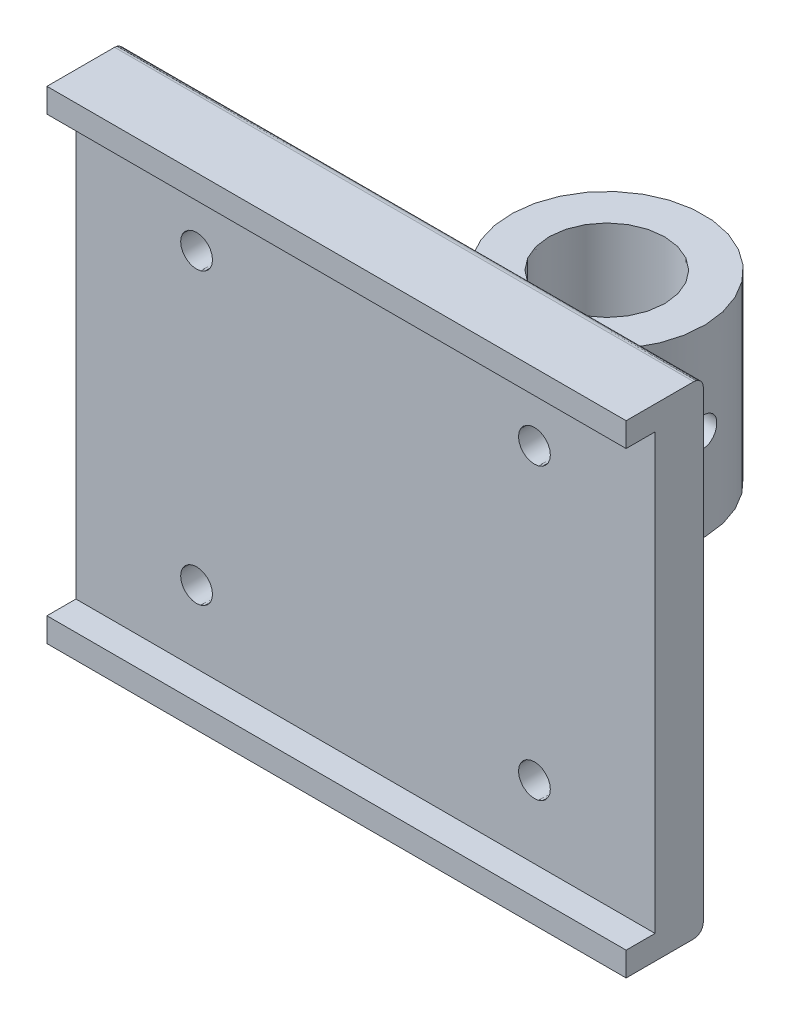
SolidWorks part; units mm, degrees
ref_plane "前视基准面" through (0, 0, 0) normal (0, 0, 1) x (1, 0, 0)
ref_plane "上视基准面" through (0, 0, 0) normal (0, 1, 0) x (1, 0, 0)
ref_plane "右视基准面" through (0, 0, 0) normal (1, 0, 0) x (0, 0, -1)
sketch "草图1" plane through (0, 0, 0) normal (0, 0, 1) x (1, 0, 0)
  line L0 (0, 15.9024) -> (0, 0) construction
  line L1 (-30, -25) -> (30, -25)
  line L2 (-30, -25) -> (-30, 25)
  line L3 (-30, 25) -> (30, 25)
  line L4 (30, -25) -> (30, 25)
  line L5 (-30, -25) -> (30, 25) construction
  line L6 (-30, 25) -> (30, -25) construction
  line L7 (0, 0) -> (-15.3171, 0) construction
  point P0 (0, 0)
  point P6 (-17.5, 15)
  point P12 (17.5, 15)
  point P13 (17.5, -15)
  point P14 (-17.5, -15)
  dimension "D1" = 50
  dimension "D2" = 60
  dimension "D3" = 35
  dimension "D4" = 30
  dimension "D5" = 2
  dimension "D6" = 2
extrude "凸台-拉伸1" add sketch "草图1" along normal blind 8
sketch "草图3" plane through (0, 0, 0) normal (0, 1, 0) x (1, 0, 0)
  line L0 (0, 0) -> (0, 37.3264) construction
  line L1 (3.5, 10.6325) -> (3.5, 0)
  line L2 (-30, 0) -> (30, 0) construction
  line L3 (-3.5, 10.6325) -> (-3.5, 0)
  line L4 (-30, 0) -> (30, 0) construction
  line L5 (-3.5, 0) -> (3.5, 0)
  circle A0 centre (0, 20) radius 6
  arc A1 (3.5, 10.6325) -> (-3.5, 10.6325) centre (0, 20) ccw
  dimension "D1" = 12
  dimension "D2" = 20
  dimension "D3" = 20
  dimension "D4" = 3.5
  dimension "D5" = 3.5
extrude "凸台-拉伸2" add sketch "草图3" along normal mid plane 19
sketch "草图4" plane through (30, 0, 0) normal (1, 0, 0) x (0, 0, -1)
  line L0 (-8, -25) -> (-8, 25) construction
  line L1 (-11, -22.5) -> (-5, -22.5)
  line L2 (-11, -22.5) -> (-11, 22.5)
  line L3 (-11, 22.5) -> (-5, 22.5)
  line L4 (-5, -22.5) -> (-5, 22.5)
  line L5 (-11, -22.5) -> (-5, 22.5) construction
  line L6 (-11, 22.5) -> (-5, -22.5) construction
  line L7 (-8, 25) -> (0, 25) construction
  line L8 (0, 25) -> (0, -25) construction
  point P0 (-8, 0)
  dimension "D1" = 2.5
  dimension "D2" = 5
extrude "切除-拉伸2" cut sketch "草图4" against normal up to surface (60 mm away)
sketch "草图7" plane through (0, 0, 0) normal (0, 0, -1) x (-1, 0, 0)
  point P0 (-17.5, -15)
  point P2 (17.5, -15)
  point P4 (17.5, 15)
  point P6 (-17.5, 15)
hole_wizard "M4 螺纹孔1" positions "3D草图4" profile "草图9" tap size "M4" standard "GB"
sketch3d "3D草图4"
  point P0 (17.5, -15, 0)
  point P3 (-17.5, -15, 0)
  point P6 (-17.5, 15, 0)
  point P9 (17.5, 15, 0)
sketch "草图9" plane through (17.5, -15, 0) normal (1, 0, 0) x (0, 1, 0)
  line L0 (0, 0) -> (0, 8)
  line L1 (0, 8) -> (1.65, 8)
  line L2 (1.65, 8) -> (1.65, 0)
  line L5 (1.65, 0) -> (0, 0)
  line L11 (0, -6.35) -> (0, 107.95) construction
  dimension "通孔螺纹孔钻头直径" = 3.3
  dimension "通孔螺纹孔钻头深度" = 8
sketch "草图10" plane through (0, 0, 0) normal (0, 1, 0) x (1, 0, 0)
  line L0 (15, 0) -> (6, 12)
  line L1 (30, 0) -> (-30, 0) construction
  arc A0 (3.5, 10.6325) -> (-3.5, 10.6325) centre (0, 20) ccw construction
  dimension "D1" = 12
  dimension "D2" = 15
rib "筋1" sketch "草图10" sketch "草图10" thickness 8 extrusion direction parallel to sketch draft on no parameters "D1"=8
mirror "镜向1" about plane through (0, 0, 0) normal (1, 0, 0) of "筋1"
sketch "草图11" plane through (0, 0, 0) normal (1, 0, 0) x (0, 0, -1)
  line L0 (26, 0) -> (14, 0) construction
  line L1 (26, -9.5) -> (26, 9.5) construction
  line L2 (14, 9.5) -> (14, -9.5) construction
  circle A0 centre (20, 0) radius 1.5
  dimension "D1" = 3
extrude "切除-拉伸3" cut sketch "草图11" against normal mid plane 41
fillet "圆角1" radius 1 6 edges at (0, -25, 0) (0, 25, 0) (-10.5, 4, -6) (-10.5, -4, -6) (10.5, -4, -6) (10.5, 4, -6)
sketch "草图12" plane through (0, 9.5, 0) normal (0, 1, 0) x (1, 0, 0)
  line L0 (-2, 7.8) -> (-2, 6.1436)
  line L1 (2, 7.8) -> (2, 6.1436)
  line L2 (2, 6.1436) -> (2, 0)
  line L3 (-3.5, 0) -> (3.5, 0) construction
  line L4 (2, 0) -> (-2, 0)
  line L5 (-30, 0) -> (30, 0) construction
  line L6 (-2, 0) -> (-2, 6.1436)
  line L7 (-2, 7.8) -> (2, 7.8)
  circle A0 centre (0, 20) radius 6 construction
  dimension "D1" = 12.2
  dimension "D3" = 2
  dimension "D4" = 2
extrude "凸台-拉伸3" add sketch "草图12" along normal blind 1.8
